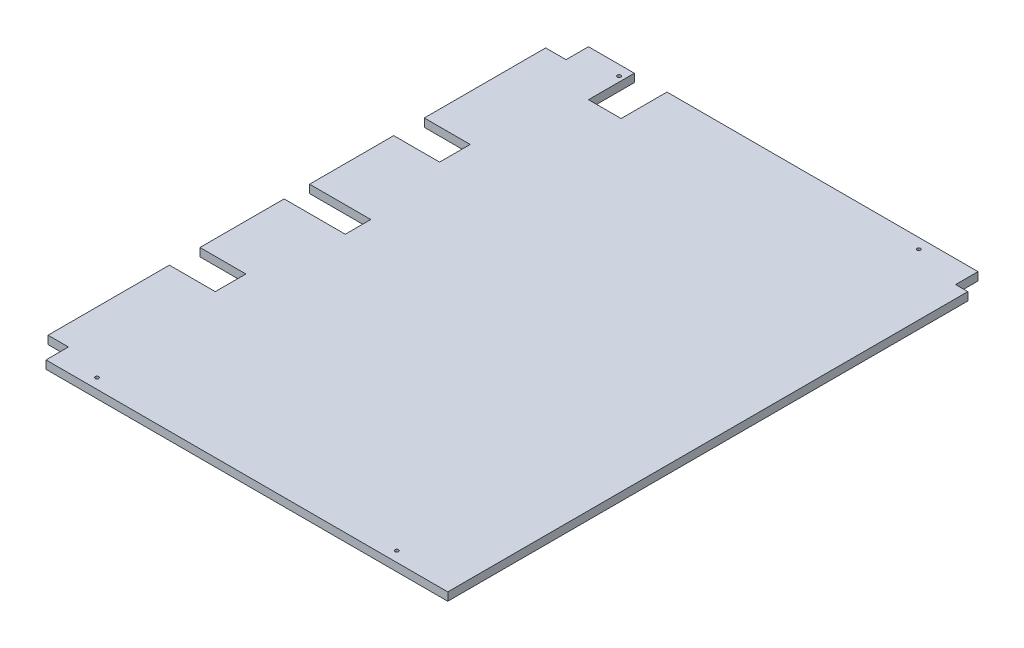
SolidWorks part; units mm, degrees
ref_plane "Ebene vorne" through (0, 0, 0) normal (0, 0, 1) x (1, 0, 0)
ref_plane "Ebene oben" through (0, 0, 0) normal (0, 1, 0) x (1, 0, 0)
ref_plane "Ebene rechts" through (0, 0, 0) normal (1, 0, 0) x (0, 0, -1)
sketch "Skizze1" plane through (0, 0, 0) normal (0, 1, 0) x (1, 0, 0)
  line L1 (-207, -266) -> (207, -266)
  line L2 (-207, -266) -> (-207, 266)
  line L3 (-207, 266) -> (207, 266)
  line L4 (207, -266) -> (207, 266)
  line L5 (-207, -266) -> (207, 266) construction
  line L6 (-207, 266) -> (207, -266) construction
  point P0 (0, 0)
  dimension "D1" = 414
  dimension "D2" = 532
extrude "Aufsatz-Linear austragen1" add sketch "Skizze1" along normal blind 8
sketch "Skizze2" plane through (0, 8, 0) normal (0, 1, 0) x (1, 0, 0)
  line L1 (-207, -266) -> (-187, -266)
  line L2 (-207, -266) -> (-207, -244)
  line L3 (-207, -244) -> (-187, -244)
  line L4 (-187, -266) -> (-187, -244)
  line L5 (-207, 266) -> (-187, 266)
  line L6 (-207, 266) -> (-207, 244)
  line L7 (-207, 244) -> (-187, 244)
  line L8 (-187, 266) -> (-187, 244)
  line L9 (207, 266) -> (195, 266)
  line L10 (207, 266) -> (207, 244)
  line L11 (207, 244) -> (195, 244)
  line L12 (195, 266) -> (195, 244)
  dimension "D1" = 20
  dimension "D2" = 22
  dimension "D3" = 22
  dimension "D4" = 20
  dimension "D5" = 12
extrude "Schnitt-Linear austragen1" cut sketch "Skizze2" against normal through all
sketch "Skizze3" plane through (0, 8, 0) normal (0, 1, 0) x (1, 0, 0)
  line L0 (-207, 244) -> (-207, -244) construction
  line L1 (-207, 125) -> (-162, 125)
  line L2 (-207, 125) -> (-207, 95)
  line L3 (-207, 95) -> (-162, 95)
  line L4 (-162, 125) -> (-162, 95)
  line L5 (-147, 0) -> (0, 0) construction
  line L6 (-207, -95) -> (-162, -95)
  line L7 (-207, -95) -> (-207, -125)
  line L8 (-207, -125) -> (-162, -125)
  line L9 (-162, -95) -> (-162, -125)
  line L11 (-207, 12.5) -> (-207, -12.5)
  line L14 (-147, 12.5) -> (-207, 12.5)
  line L15 (-147, -12.5) -> (-207, -12.5)
  line L16 (-147, 12.5) -> (-147, -12.5)
  line L22 (195, 266) -> (-187, 266) construction
  line L23 (-142, 266) -> (-110, 266)
  line L24 (-142, 266) -> (-142, 221)
  line L25 (-142, 221) -> (-110, 221)
  line L26 (-110, 266) -> (-110, 221)
  point P14 (-162, -110)
  point P16 (-162, 110)
  point P20 (-147, 0)
  dimension "D1" = 60
  dimension "D2" = 30
  dimension "D3" = 110
  dimension "D4" = 110
  dimension "D5" = 45
  dimension "D6" = 25
  dimension "D10" = 65
  dimension "D11" = 32
  dimension "D12" = 45
extrude "Schnitt-Linear austragen2" cut sketch "Skizze3" against normal through all
hole_wizard "Ø3.5 (3.5) Durchmesser Bohrung1" positions "Skizze4" profile "Skizze5" hole size "Ø3.5" standard "DIN"
sketch "Skizze4" plane through (0, 8, 0) normal (0, 1, 0) x (1, 0, 0)
  line L0 (195, 266) -> (-110, 266) construction
  line L1 (-187, -266) -> (207, -266) construction
  line L2 (207, -266) -> (207, 244) construction
  line L3 (-207, -125) -> (-207, -244) construction
  point P0 (-147, -256)
  point P2 (147, -256)
  point P4 (147, 256)
  point P6 (-147, 256)
  dimension "D1" = 10
  dimension "D2" = 10
  dimension "D3" = 60
  dimension "D4" = 60
sketch "Skizze5" plane through (-147, 8, 256) normal (1, 0, 0) x (0, 0, 1)
  line L0 (0, 0) -> (0, 8)
  line L1 (0, 8) -> (1.75, 8)
  line L2 (1.75, 8) -> (1.75, 0)
  line L5 (1.75, 0) -> (0, 0)
  line L11 (0, -6.35) -> (0, 107.95) construction
  dimension "Bohrerdurchmesser" = 3.5
  dimension "Bohrungstiefe" = 8
chamfer "Fase1" distance 1.5 angle 45 4 edges at (147, 0, -254.25) (-147, 0, -254.25) (-147, 0, 257.75) (147, 0, 257.75)
